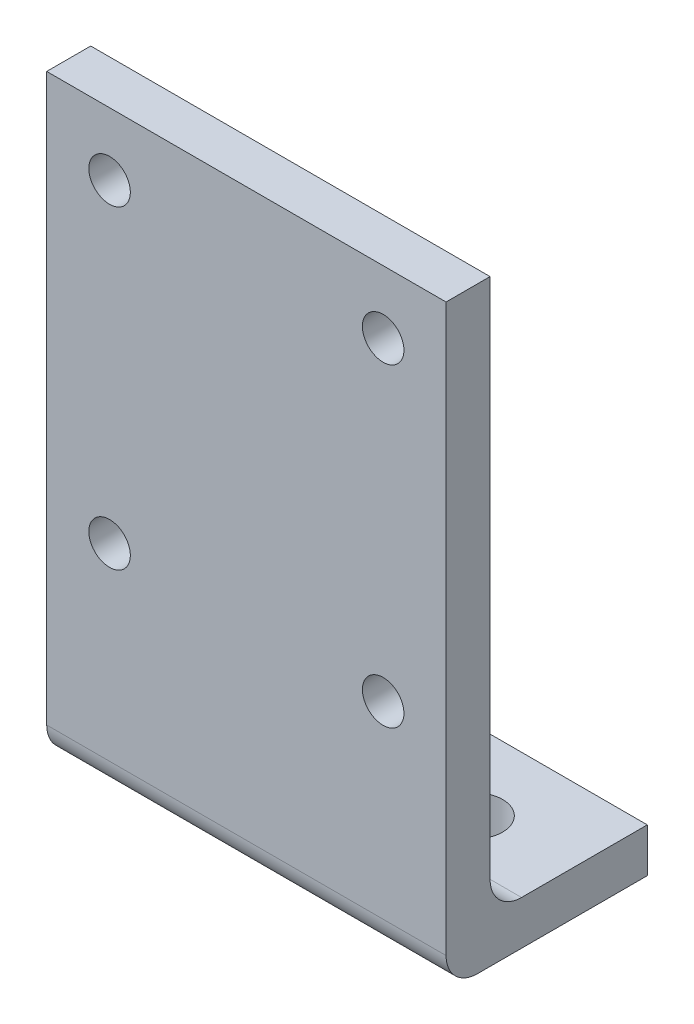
SolidWorks part; units mm, degrees
ref_plane "Front Plane" through (0, 0, 0) normal (0, 0, 1) x (1, 0, 0)
ref_plane "Top Plane" through (0, 0, 0) normal (0, 1, 0) x (1, 0, 0)
ref_plane "Right Plane" through (0, 0, 0) normal (1, 0, 0) x (0, 0, -1)
sketch "Sketch1" plane through (0, 0, 0) normal (0, 0, 1) x (1, 0, 0)
  line L1 (-31.75, -47.5) -> (31.75, -47.5)
  line L2 (-31.75, -47.5) -> (-31.75, 47.5)
  line L3 (-31.75, 47.5) -> (31.75, 47.5)
  line L4 (31.75, -47.5) -> (31.75, 47.5)
  line L5 (-31.75, -47.5) -> (31.75, 47.5) construction
  line L6 (-31.75, 47.5) -> (31.75, -47.5) construction
  point P0 (0, 0)
  dimension "D1" = 63.5
  dimension "D2" = 95
extrude "Extrude1" add sketch "Sketch1" along normal blind 7
sketch "Sketch3" plane through (0, 0, 0) normal (0, 0, -1) x (-1, 0, 0)
  line L0 (31.75, 47.5) -> (31.75, -47.5) construction
  line L1 (-31.75, -47.5) -> (31.75, -47.5)
  line L2 (-31.75, -47.5) -> (-31.75, -40.5)
  line L3 (-31.75, -40.5) -> (31.75, -40.5)
  line L4 (31.75, -47.5) -> (31.75, -40.5)
  dimension "D1" = 7
extrude "Extrude3" add sketch "Sketch3" along normal blind 25
hole_wizard "M6 Clearance Hole1" positions "Sketch4" profile "Sketch5" hole size "M6" standard "Ansi Metric"
sketch "Sketch4" plane through (0, -31.875, 7) normal (0, 0, 1) x (1, 0, 0)
  line L1 (-21.75, 69.375) -> (21.75, 69.375) construction
  line L2 (-21.75, 69.375) -> (-21.75, 19.375) construction
  line L3 (-21.75, 19.375) -> (21.75, 19.375) construction
  line L4 (21.75, 69.375) -> (21.75, 19.375) construction
  point P0 (-21.75, 69.375)
  point P1 (21.75, 69.375)
  point P2 (21.75, 19.375)
  point P3 (-21.75, 19.375)
sketch "Sketch5" plane through (-21.75, 37.5, 7) normal (1, 0, 0) x (0, -1, 0)
  line L0 (0, 0) -> (0, 32)
  line L1 (0, 32) -> (3.3, 32)
  line L2 (3.3, 32) -> (3.3, 0)
  line L3 (3.3, 0) -> (0, 0)
  line L4 (0, -6.35) -> (0, 107.95) construction
  dimension "Thru Hole Dia." = 6.6
  dimension "Thru Hole Depth" = 32
hole_wizard "M8 Clearance Hole1" positions "Sketch6" profile "Sketch7" hole size "M8" standard "Ansi Metric"
sketch "Sketch6" plane through (0, -40.5, 13.35) normal (0, 1, 0) x (-1, 0, 0)
  point P0 (16.75, -25.85)
  point P1 (-16.75, -25.85)
sketch "Sketch7" plane through (-16.75, -40.5, -12.5) normal (1, 0, 0) x (0, 0, 1)
  line L0 (0, 0) -> (0, 7)
  line L1 (0, 7) -> (4.5, 7)
  line L2 (4.5, 7) -> (4.5, 0)
  line L5 (4.5, 0) -> (0, 0)
  line L11 (0, -6.35) -> (0, 107.95) construction
  dimension "Thru Hole Dia." = 9
  dimension "Thru Hole Depth" = 7
fillet "Fillet1" radius 5 1 edges at (0, -47.5, 7)
fillet "Fillet2" radius 5 2 edges
